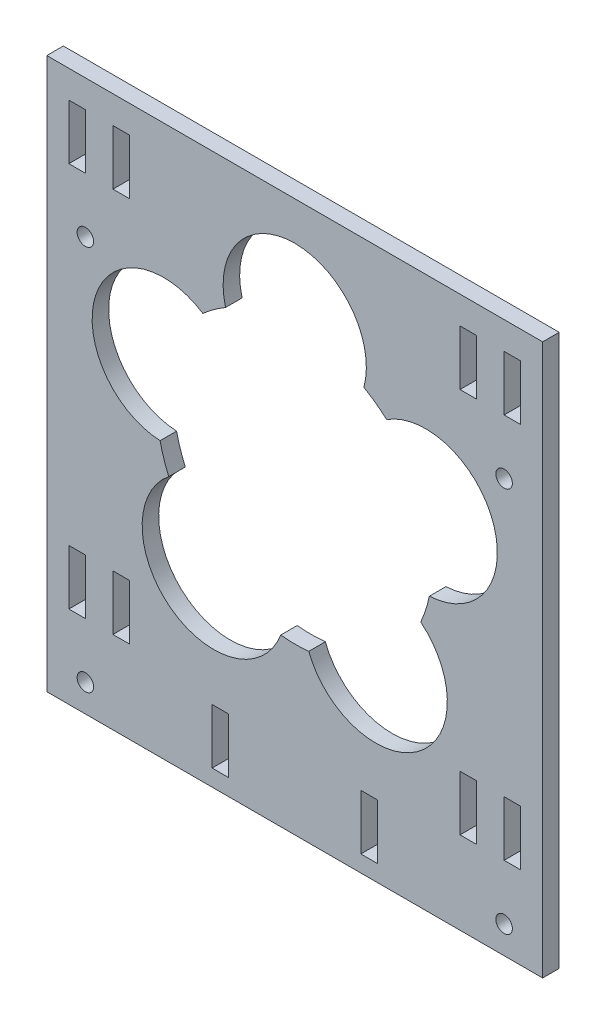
SolidWorks part; units mm, degrees
ref_plane "前视基准面" through (0, 0, 0) normal (0, 0, 1) x (1, 0, 0)
ref_plane "上视基准面" through (0, 0, 0) normal (0, 1, 0) x (1, 0, 0)
ref_plane "右视基准面" through (0, 0, 0) normal (1, 0, 0) x (0, 0, -1)
sketch "草图1" plane through (0, 0, 0) normal (0, 0, 1) x (1, 0, 0)
  line L0 (0, 0) -> (-23.7764, 7.7254) construction
  circle A0 centre (0, 0) radius 12.5
  circle A1 centre (0, 25) radius 12.5
  circle A2 centre (23.7764, 7.7254) radius 12.5
  circle A3 centre (14.6946, -20.2254) radius 12.5
  circle A4 centre (-14.6946, -20.2254) radius 12.5
  circle A5 centre (-23.7764, 7.7254) radius 12.5
  circle A6 centre (-23.7764, 7.7254) radius 10.5
  circle A7 centre (0, 25) radius 10.5
  circle A8 centre (23.7764, 7.7254) radius 10.5
  circle A9 centre (-14.6946, -20.2254) radius 10.5
  circle A10 centre (14.6946, -20.2254) radius 10.5
  circle A11 centre (-23.7764, 7.7254) radius 9
  circle A12 centre (0, 25) radius 9
  circle A13 centre (23.7764, 7.7254) radius 9
  circle A14 centre (14.6946, -20.2254) radius 9
  circle A15 centre (-14.6946, -20.2254) radius 9
  circle A17 centre (0, 0) radius 35.5
  point P16 (0, 0)
  dimension "D1" = 25
  dimension "D2" = 25
  dimension "D4" = 21
  dimension "D5" = 21
  dimension "D6" = 21
  dimension "D7" = 21
  dimension "D8" = 18
  dimension "D11" = 21
  dimension "D3" = 5
  dimension "D10" = 25
  dimension "D9" = 5
sketch "草图2" plane through (0, 0, 0) normal (0, 0, 1) x (1, 0, 0)
  line L0 (-10.5, 25) -> (-10.5, 27.9643)
  line L1 (10.5, 25) -> (10.5, 27.9643)
  line L2 (20.5317, 17.7115) -> (23.3509, 18.6275)
  line L3 (27.0211, -2.2607) -> (29.8403, -1.3447)
  line L4 (23.1893, -14.0537) -> (24.9317, -16.4518)
  line L5 (6.2, -26.3972) -> (7.9423, -28.7953)
  line L6 (-6.2, -26.3972) -> (-7.9423, -28.7953)
  line L7 (-23.1893, -14.0537) -> (-24.9317, -16.4518)
  line L8 (-27.0211, -2.2607) -> (-29.8403, -1.3447)
  line L9 (-20.5317, 17.7115) -> (-23.3509, 18.6275)
  line L11 (0, 0) -> (27.0211, -2.2607) construction
  circle A0 centre (14.6946, -20.2254) radius 10.5 construction
  circle A1 centre (-14.6946, -20.2254) radius 10.5 construction
  circle A2 centre (23.7764, 7.7254) radius 10.5 construction
  circle A3 centre (0, 25) radius 10.5 construction
  circle A4 centre (-23.7764, 7.7254) radius 10.5 construction
  circle A5 centre (0, 0) radius 35.5 construction
  arc A6 (23.1893, -14.0537) -> (6.2, -26.3972) centre (14.6946, -20.2254) ccw
  arc A7 (-6.2, -26.3972) -> (-23.1893, -14.0537) centre (-14.6946, -20.2254) ccw
  arc A8 (20.5317, 17.7115) -> (27.0211, -2.2607) centre (23.7764, 7.7254) ccw
  arc A9 (-10.5, 25) -> (10.5, 25) centre (0, 25) ccw
  arc A10 (-27.0211, -2.2607) -> (-20.5317, 17.7115) centre (-23.7764, 7.7254) ccw
  arc A11 (-16.3413, 31.5153) -> (-24.9231, 25.2802) centre (0, 0) ccw
  arc A12 (-35.0225, -5.8027) -> (-31.7446, -15.8912) centre (0, 0) ccw
  arc A13 (24.9231, 25.2802) -> (16.3413, 31.5153) centre (0, 0) ccw
  arc A14 (31.7446, -15.8912) -> (35.0225, -5.8027) centre (0, 0) ccw
  arc A15 (-5.3039, -35.1016) -> (5.3039, -35.1016) centre (0, 0) ccw
  arc A16 (23.3509, 18.6275) -> (24.9231, 25.2802) centre (22.1148, 22.4318) ccw
  arc A17 (10.5, 27.9643) -> (16.3413, 31.5153) centre (14.5, 27.9643) cw
  arc A18 (-10.5, 27.9643) -> (-16.3413, 31.5153) centre (-14.5, 27.9643) ccw
  arc A19 (-23.3509, 18.6275) -> (-24.9231, 25.2802) centre (-22.1148, 22.4318) cw
  arc A20 (24.9317, -16.4518) -> (31.7446, -15.8912) centre (28.1677, -14.1007) ccw
  arc A21 (7.9423, -28.7953) -> (5.3039, -35.1016) centre (4.7062, -31.1465) cw
  arc A22 (-7.9423, -28.7953) -> (-5.3039, -35.1016) centre (-4.7062, -31.1465) ccw
  arc A23 (-24.9317, -16.4518) -> (-31.7446, -15.8912) centre (-28.1677, -14.1007) cw
  arc A24 (-35.0225, -5.8027) -> (-29.8403, -1.3447) centre (-31.0763, -5.1489) cw
  arc A25 (29.8403, -1.3447) -> (35.0225, -5.8027) centre (31.0763, -5.1489) cw
  dimension "D2" = 4
  dimension "D3" = 4
  dimension "D1" = 5
sketch "草图3" plane through (0, 0, 0) normal (0, 0, 1) x (1, 0, 0)
  line L0 (-45, 45) -> (45, 45)
  line L1 (45, 45) -> (45, -45)
  line L3 (-45, -45) -> (-45, 45)
  line L4 (-45, -45) -> (-45, -55)
  line L7 (-45, -55) -> (45, -55)
  line L8 (45, -45) -> (45, -55)
  dimension "D1" = 90
  dimension "D2" = 90
  dimension "D3" = 10
extrude "凸台-拉伸2" add sketch "草图3" along normal blind 3
sketch "草图4" plane through (0, 0, 3) normal (0, 0, 1) x (1, 0, 0)
  circle A0 centre (0, 0) radius 13.5
sketch "草图5" plane through (0, 0, 3) normal (0, 0, 1) x (1, 0, 0)
  line L0 (-33, 40) -> (-33, 30)
  line L1 (-33, 30) -> (-30, 30)
  line L2 (-30, 30) -> (-30, 40)
  line L3 (-30, 40) -> (-33, 40)
  line L4 (30, 40) -> (30, 30)
  line L5 (30, 30) -> (33, 30)
  line L6 (33, 30) -> (33, 40)
  line L7 (33, 40) -> (30, 40)
  line L8 (-33, -30) -> (-33, -40)
  line L9 (-33, -40) -> (-30, -40)
  line L10 (-30, -40) -> (-30, -30)
  line L11 (-30, -30) -> (-33, -30)
  line L12 (30, -30) -> (30, -40)
  line L13 (30, -40) -> (33, -40)
  line L14 (33, -40) -> (33, -30)
  line L15 (33, -30) -> (30, -30)
  line L16 (0, 45) -> (0, -54.353) construction
  line L17 (-45, 45) -> (45, 45) construction
  line L18 (-45, 0) -> (45, 0) construction
  line L19 (-45, -55) -> (-45, 45) construction
  line L20 (45, -55) -> (45, 45) construction
  dimension "D1" = 3
  dimension "D2" = 10
  dimension "D3" = 10
  dimension "D4" = 3
  dimension "D5" = 10
  dimension "D6" = 3
  dimension "D7" = 3
  dimension "D8" = 10
  dimension "D9" = 30
  dimension "D10" = 30
  dimension "D11" = 30
  dimension "D12" = 30
  dimension "D13" = 30
  dimension "D14" = 30
  dimension "D15" = 30
  dimension "D16" = 30
extrude "切除-拉伸1" cut sketch "草图5" against normal blind 10
sketch "草图6" plane through (0, 0, 3) normal (0, 0, 1) x (1, 0, 0)
  circle A15 centre (0, 25) radius 13
  circle A16 centre (23.7764, 7.7254) radius 13
  circle A17 centre (14.6946, -20.2254) radius 13
  circle A18 centre (-14.6946, -20.2254) radius 13
  circle A19 centre (-23.7764, 7.7254) radius 13
  dimension "D1" = 26
  dimension "D2" = 26
  dimension "D3" = 26
  dimension "D4" = 26
  dimension "D5" = 26
extrude "切除-拉伸2" cut sketch "草图6" against normal blind 10
sketch "草图7" plane through (0, 0, 3) normal (0, 0, 1) x (1, 0, 0)
  circle A0 centre (0, 0) radius 7
  circle A1 centre (0, -9.5) radius 1.5
  circle A2 centre (-8.2272, 4.75) radius 1.5
  circle A3 centre (8.2272, 4.75) radius 1.5
  point P11 (0, 0)
  dimension "D1" = 14
  dimension "D2" = 3
  dimension "D3" = 9.5
  dimension "D4" = 3
extrude "切除-拉伸3" cut sketch "草图7" against normal blind 10
sketch "草图8" plane through (0, 0, 3) normal (0, 0, 1) x (1, 0, 0)
  line L0 (-38, -30) -> (-38, -40)
  line L1 (-38, -40) -> (-41, -40)
  line L2 (-41, -40) -> (-41, -30)
  line L3 (-41, -30) -> (-38, -30)
  line L4 (-41, 40) -> (-41, 30)
  line L5 (-41, 30) -> (-38, 30)
  line L6 (-38, 30) -> (-38, 40)
  line L7 (-38, 40) -> (-41, 40)
  line L8 (0, 45) -> (0, -55) construction
  line L9 (-45, 45) -> (45, 45) construction
  line L10 (-45, -55) -> (45, -55) construction
  line L11 (-33, -30) -> (-33, -40) construction
  line L13 (-30, 40) -> (-33, 40) construction
  line L14 (-15, -42) -> (-12, -42)
  line L15 (-12, -42) -> (-12, -52)
  line L16 (-12, -52) -> (-15, -52)
  line L17 (-15, -52) -> (-15, -42)
  line L18 (15, -52) -> (15, -42)
  line L19 (12, -52) -> (15, -52)
  line L20 (12, -42) -> (12, -52)
  line L21 (15, -42) -> (12, -42)
  line L22 (38, 40) -> (41, 40)
  line L23 (38, 30) -> (38, 40)
  line L24 (41, 30) -> (38, 30)
  line L25 (41, 40) -> (41, 30)
  line L26 (41, -30) -> (38, -30)
  line L27 (41, -40) -> (41, -30)
  line L28 (38, -40) -> (41, -40)
  line L29 (38, -30) -> (38, -40)
  circle A0 centre (-38, -50) radius 1.5
  circle A1 centre (-38, 20) radius 1.5
  circle A2 centre (38, 20) radius 1.5
  circle A3 centre (38, -50) radius 1.5
  dimension "D11" = 3
  dimension "D12" = 5
  dimension "D13" = 25
  dimension "D1" = 3
  dimension "D2" = 10
  dimension "D3" = 5
  dimension "D4" = 15
  dimension "D5" = 3
  dimension "D6" = 10
  dimension "D7" = 10
  dimension "D8" = 3
  dimension "D9" = 3
  dimension "D10" = 12
extrude "切除-拉伸4" cut sketch "草图8" against normal blind 10
sketch "草图9" plane through (0, 0, 3) normal (0, 0, 1) x (1, 0, 0)
  circle A0 centre (0, 0) radius 25
  dimension "D1" = 50
extrude "切除-拉伸5" cut sketch "草图9" against normal blind 10
